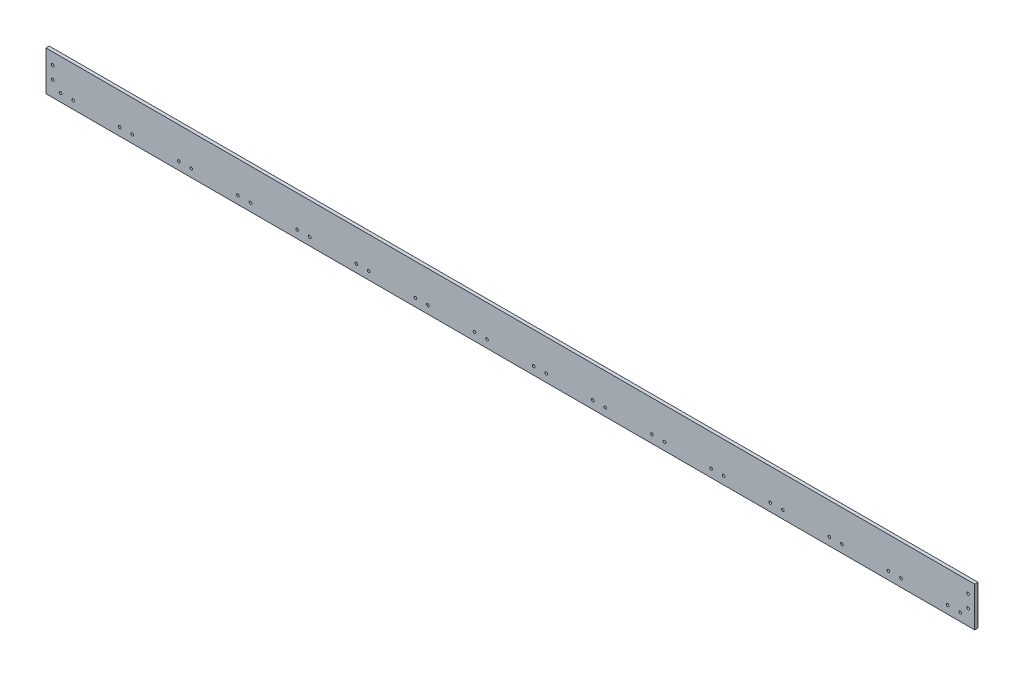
SolidWorks part; units mm, degrees
ref_plane "Front Plane" through (0, 0, 0) normal (0, 0, 1) x (1, 0, 0)
ref_plane "Top Plane" through (0, 0, 0) normal (0, 1, 0) x (1, 0, 0)
ref_plane "Right Plane" through (0, 0, 0) normal (1, 0, 0) x (0, 0, -1)
sketch "Sketch1" plane through (0, 0, 0) normal (0, 0, 1) x (1, 0, 0)
  line L1 (0, 0) -> (1784.35, 0)
  line L2 (0, 0) -> (0, 76.2)
  line L3 (0, 76.2) -> (1784.35, 76.2)
  line L4 (1784.35, 0) -> (1784.35, 76.2)
extrude "Boss-Extrude1" add sketch "Sketch1" along normal blind 6.35
sketch "Sketch2" plane through (0, 0, 6.35) normal (0, 0, 1) x (1, 0, 0)
  line L0 (27.94, 0) -> (27.94, 12.7) construction
  line L2 (0, 15.24) -> (25.4, 15.24) construction
  line L3 (0, 76.2) -> (0, 0) construction
  line L4 (0, 0) -> (1784.35, 0) construction
  line L5 (30.48, 15.24) -> (49.53, 15.24) construction
  circle A0 centre (27.94, 15.24) radius 2.54
  circle A1 centre (52.07, 15.24) radius 2.54
  point P13 (1219.2, 76.2)
extrude "Cut-Extrude1" cut sketch "Sketch2" against normal up to surface (6.35 mm away) contours A1 | A0
sketch "Sketch3" plane through (0, 0, 6.35) normal (0, 0, 1) x (1, 0, 0)
  line L0 (0, 76.2) -> (0, 0) construction
  line L1 (1784.35, 76.2) -> (0, 76.2) construction
  line L2 (12.7, 41.91) -> (0, 41.91) construction
  line L3 (12.7, 51.435) -> (12.7, 32.385) construction
  line L4 (0, 41.91) -> (0, 38.1) construction
  line L5 (892.175, 76.2) -> (892.175, 0) construction
  line L6 (0, 0) -> (1784.35, 0) construction
  circle A0 centre (12.7, 29.845) radius 2.54
  circle A1 centre (12.7, 53.975) radius 2.54
  circle A2 centre (1771.65, 29.845) radius 2.54
  circle A3 centre (1771.65, 53.975) radius 2.54
  point P13 (0, 38.1)
  point P15 (892.175, 76.2)
  point P17 (12.7, 41.91)
  point P27 (12.7, 41.91)
extrude "Cut-Extrude2" cut sketch "Sketch3" against normal up to surface (6.35 mm away)
pattern_linear "LPattern2" count 16 spacing 113.6227 along (1, 0, 0) of "Cut-Extrude1"
equation "\"vertical-component-width\"= \"railing-hypotenuse\" - \"railing-hypotenuse-vertical-component-width-difference\""
equation "\"vertical-component-height\"= 3in"
equation "\"material-thickness\"= .25in"
equation "\"D1@Sketch1\"=\"vertical-component-height\""
equation "\"D2@Sketch1\"=\"vertical-component-width\""
equation "\"D1@Boss-Extrude1\"=\"material-thickness\""
equation "\"mounting-hole-diameter\"= .2"
equation "\"mounting-hole-pair-left-to-mount-edge-left\"= 1in"
equation "\"mounting-hole-bottom-to-mount-edge-bottom\"= .5in"
equation "\"mounting-hole-pair-distance-between-holes\"= .75in"
equation "\"distance-between-mounting-hole-pairs\"= ( \"vertical-component-width\" - 2 * \"mounting-hole-pair-left-to-mount-edge-left\" - \"num-mounting-hole-pairs\" * ( 2 * \"mounting-hole-diameter\" + \"mounting-hole-pa"
equation "\"num-mounting-hole-pairs\" = 16"
equation "\"D3@Sketch2\"=\"mounting-hole-pair-distance-between-holes\""
equation "\"D5@Sketch2\"=\"mounting-hole-bottom-to-mount-edge-bottom\""
equation "\"D4@Sketch2\"=\"mounting-hole-pair-left-to-mount-edge-left\""
equation "\"D3@LPattern2\"=\"mounting-hole-pair-left-to-next-mounting-hole-pair-left\""
equation "\"D2@Sketch2\"=\"mounting-hole-diameter\""
equation "\"D1@Sketch2\"=\"mounting-hole-diameter\""
equation "\"mounting-hole-pair-left-to-next-mounting-hole-pair-left\"= \"distance-between-mounting-hole-pairs\" + 2 * \"mounting-hole-diameter\" + \"mounting-hole-pair-distance-between-holes\""
equation "\"edge-mounting-hole-pair-inset\"=0.5"
equation "\"D4@Sketch3\"=\"edge-mounting-hole-pair-inset\""
equation "\"edge-mounting-hole-pair-offset-from-mount-vertical-center\"= 0.15"
equation "\"D5@Sketch3\"=\"edge-mounting-hole-pair-offset-from-mount-vertical-center\""
equation "\"D3@Sketch3\"=\"mounting-hole-pair-distance-between-holes\""
equation "\"railing-hypotenuse\"= 72in"
equation "\"railing-hypotenuse-vertical-component-width-difference\"= 1.75in"
equation "\"D1@LPattern2\"=\"num-mounting-hole-pairs\""
